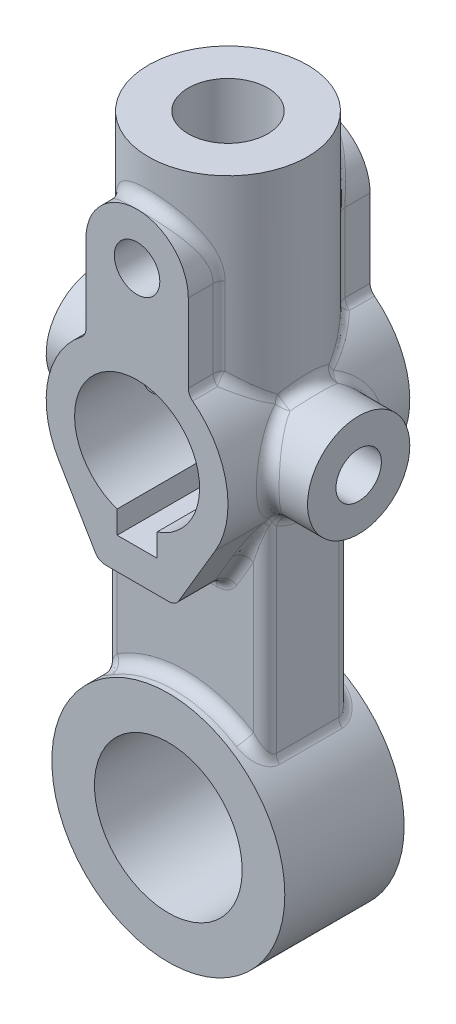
SolidWorks part; units mm, degrees
ref_plane "Front Plane" through (0, 0, 0) normal (0, 0, 1) x (1, 0, 0)
ref_plane "Top Plane" through (0, 0, 0) normal (0, 1, 0) x (1, 0, 0)
ref_plane "Right Plane" through (0, 0, 0) normal (1, 0, 0) x (0, 0, -1)
sketch "Sketch1" plane through (0, 0, 0) normal (0, 0, 1) x (1, 0, 0)
  line L0 (0, 0) -> (0, -62.4284) construction
  line L1 (-10.7188, -31.75) -> (10.7188, -31.75)
  line L2 (10.7188, -31.75) -> (21.8559, -12.9415)
  line L3 (-10.7188, -31.75) -> (-21.8559, -12.9415)
  line L4 (14.3002, 20.992) -> (14.3002, 44.45)
  line L5 (-14.3002, 20.992) -> (-14.3002, 44.45)
  arc A0 (-14.3002, 20.992) -> (-21.8559, -12.9415) centre (0, 0) ccw
  arc A1 (-14.3002, 44.45) -> (14.3002, 44.45) centre (0, 44.45) cw
  arc A2 (21.8559, -12.9415) -> (14.3002, 20.992) centre (0, 0) ccw
  point P7 (0, -31.75)
  dimension "D1" = 14.3002
  dimension "D2" = 44.45
  dimension "D4" = 25.4
  dimension "D3" = 31.75
  dimension "D5" = 21.4376
extrude "Extrude1" add sketch "Sketch1" along normal mid plane 50.8
sketch "Sketch2" plane through (0, 0, 0) normal (0, 1, 0) x (1, 0, 0)
  circle A0 centre (0, 0) radius 22.225
  dimension "D1" = 44.45
extrude "Extrude2" add sketch "Sketch2" along normal blind 69.85
sketch "Sketch3" plane through (0, 0, 0) normal (0, 1, 0) x (1, 0, 0)
  line L0 (22.225, 11.9126) -> (-22.225, -11.9126) construction
  line L1 (-22.225, 11.9126) -> (22.225, 11.9126)
  line L2 (-22.225, 11.9126) -> (-22.225, -11.9126)
  line L3 (-22.225, -11.9126) -> (22.225, -11.9126)
  line L4 (22.225, 11.9126) -> (22.225, -11.9126)
  circle A0 centre (0, 0) radius 22.225 construction
  dimension "D1" = 23.8252
extrude "Extrude3" add sketch "Sketch3" against normal blind 95.25
sketch "Sketch4" plane through (0, 0, 0) normal (0, 0, 1) x (1, 0, 0)
  line L0 (-22.225, -95.25) -> (22.225, -95.25) construction
  circle A0 centre (0, -95.25) radius 32.5501
  dimension "D1" = 65.1002
extrude "Extrude4" add sketch "Sketch4" along normal mid plane 33.3502
sketch "Sketch5" plane through (0, 0, 0) normal (1, 0, 0) x (0, 0, -1)
  circle A0 centre (0, 0) radius 14.2875
  dimension "D1" = 28.575
extrude "Extrude5" add sketch "Sketch5" along normal mid plane 73.025
sketch "Sketch6" plane through (0, 0, 0) normal (0, 0, 1) x (1, 0, 0)
  line L0 (0, 0) -> (0, -22.9028) construction
  line L1 (-5.5626, -22.9028) -> (5.5626, -22.9028)
  line L2 (5.5626, -22.9028) -> (5.5626, -16.5528)
  line L3 (-5.5626, -22.9028) -> (-5.5626, -16.5528)
  arc A0 (5.5626, -16.5528) -> (-5.5626, -16.5528) centre (0, 0) ccw
  dimension "D1" = 34.925
  dimension "D2" = 11.1252
  dimension "D3" = 6.35
extrude "Cut-Extrude1" cut sketch "Sketch6" against normal through all and the other way through all
sketch "Sketch7" plane through (0, 0, 0) normal (0, 0, 1) x (1, 0, 0)
  circle A0 centre (0, 44.45) radius 6.35
  dimension "D1" = 12.7
extrude "Cut-Extrude2" cut sketch "Sketch7" against normal through all and the other way through all
sketch "Sketch8" plane through (0, 0, 0) normal (1, 0, 0) x (0, 0, -1)
  circle A0 centre (0, 0) radius 6.35
  dimension "D1" = 12.7
extrude "Cut-Extrude3" cut sketch "Sketch8" against normal through all and the other way through all
sketch "Sketch9" plane through (0, 69.85, 0) normal (0, 1, 0) x (-1, 0, 0)
  circle A0 centre (0, 0) radius 11.1125
  dimension "D1" = 22.225
extrude "Cut-Extrude4" cut sketch "Sketch9" against normal blind 69.85
sketch "Sketch10" plane through (0, 0, 0) normal (0, 0, 1) x (1, 0, 0)
  circle A0 centre (0, -95.25) radius 20.6375
  dimension "D1" = 41.275
extrude "Cut-Extrude5" cut sketch "Sketch10" against normal through all and the other way through all
fillet "Fillet1" radius 3.175 8 edges at (-10.7188, -31.75, 18.6563) (10.7188, -31.75, 18.6563) (-10.7188, -31.75, -18.6563) (10.7188, -31.75, -18.6563) (-22.225, -41.8826, 11.9126) (-22.225, -41.8826, -11.9126) (22.225, -41.8826, -11.9126) (22.225, -41.8826, 11.9126)
fillet "Fillet2" radius 3.175 4 edges at (-14.3002, 20.992, 21.2067) (14.3002, 20.992, 21.2067) (14.3002, 20.992, -21.2067) (-14.3002, 20.992, -21.2067)
fillet "Fillet3" radius 3.175 44 edges at (20.6956, 14.7259, -8.102) (14.4673, 21.592, -16.8715) (14.3002, 33.5293, -17.0134) (-20.9563, 14.3525, -7.4017) (-14.744, 20.9896, -16.6302) (-14.3002, 33.5293, -17.0134) (-20.1, 15.529, 9.4837) (-14.4673, 21.592, 16.8715) (-14.3002, 33.5293, 17.0134) (18.4937, 17.411, 12.3262) (14.744, 20.9896, 16.6302) (14.3002, 33.5293, 17.0134) (-22.225, -12.2967, 8.0062) (-22.1769, -12.3833, 9.2883) (-20.6875, -14.9146, 11.4577) (-15.3455, -23.9364, 11.9126) (-10.4813, -31.3333, 11.9126) (22.225, -12.2967, 8.0062) (22.0867, -12.5435, 9.6646) (20.6875, -14.9146, 11.4577) (15.3455, -23.9364, 11.9126) (10.4813, -31.3333, 11.9126) (22.225, -12.2967, -8.0062) (22.1769, -12.3833, -9.2883) (20.6875, -14.9146, -11.4577) (15.3455, -23.9364, -11.9126) (10.4813, -31.3333, -11.9126) (-22.225, -12.2967, -8.0062) (-22.0867, -12.5435, -9.6646) (-20.6875, -14.9146, -11.4577) (-15.3455, -23.9364, -11.9126) (-10.4813, -31.3333, -11.9126) (21.4188, -70.7399, -10.8517) (22.225, -71.4685, 0) (21.7881, -71.0676, 10.345) (0, -62.6999, 11.9126) (-21.4188, -70.7399, 10.8517) (-22.225, -71.4685, 0) (-21.7881, -71.0676, -10.345) (0.3568, 58.7457, 22.2221) (0.3568, 30.1543, -22.2221) (0, -31.75, 11.9126) (0, -31.75, -11.9126) (0, -62.6999, -11.9126)
fillet "Fillet4" radius 3.175 16 edges at (21.7722, 13.4348, -4.8621) (25.3998, 0.1076, -14.2871) (22.225, -14.2875, 0) (22.2339, -12.8539, 6.2377) (25.3998, 0.1076, -14.2871) (21.7855, 13.1451, 5.5982) (-21.7855, 13.1451, -5.5982) (-22.2221, 14.283, -0.3586) (-21.782, 13.49, 4.7067) (-25.3998, -0.1076, -14.2871) (-22.225, -14.2875, 0) (-22.2339, -12.8539, -6.2377) (-25.3998, -0.1076, -14.2871)
